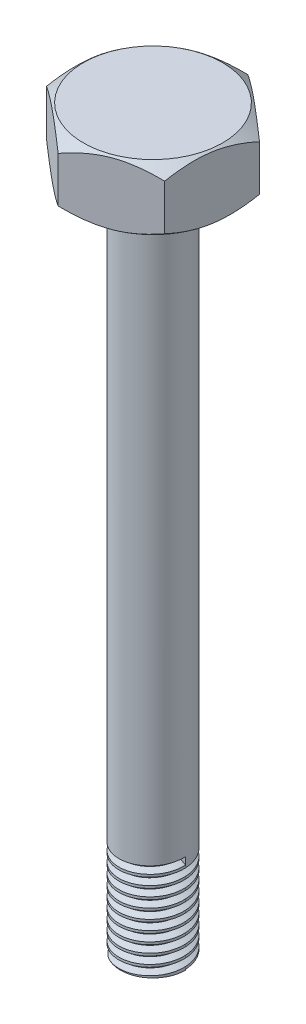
SolidWorks part; units mm, degrees
ref_plane "Front Plane" through (0, 0, 0) normal (0, 0, 1) x (1, 0, 0)
ref_plane "Top Plane" through (0, 0, 0) normal (0, 1, 0) x (1, 0, 0)
ref_plane "Right Plane" through (0, 0, 0) normal (1, 0, 0) x (0, 0, -1)
sketch "Sketch1" plane through (0, 0, 0) normal (0, 1, 0) x (1, 0, 0)
  circle A0 centre (0, 0) radius 5
  dimension "D1" = 10
extrude "Boss-Extrude1" add sketch "Sketch1" along normal blind 103
thread "Thread1" pitch 1.5 start angle 0, offset 1, length 15, pitch 1.5, diameter 10
ref_plane "Plane1" through (5, -1, 0) normal (0, 0, 1) x (1, 0, 0)
sketch "Thread Profile1" plane through (5, -1, 0) normal (0, 0, 1) x (1, 0, 0)
  line L0 (0, 0) -> (0, 1.5) construction
  line L1 (0, 1.125) -> (-0.8119, 0.6563)
  line L2 (-0.8119, 0.6563) -> (-0.8119, 0.4688)
  line L3 (-0.8119, 0.4688) -> (0, 0)
  line L4 (-0.8119, 0.5625) -> (0, 0.5625) construction
  line L11 (0, 1.125) -> (0, 0)
  point P6 (0, 0)
  dimension "Pitch" = 1.5
  dimension "Profile_Angle" = 60
  dimension "Profile_Land" = 0.1875
  dimension "Profile_Height" = 0.8119
sketch "Sketch4" plane through (0, 103, 0) normal (0, 1, 0) x (1, 0, 0)
  line L1 (11.8807, 4.4924) -> (2.0498, 12.5352)
  line L2 (2.0498, 12.5352) -> (-9.8309, 8.0428)
  line L3 (-9.8309, 8.0428) -> (-11.8807, -4.4924)
  line L4 (-11.8807, -4.4924) -> (-2.0498, -12.5352)
  line L5 (-2.0498, -12.5352) -> (9.8309, -8.0428)
  line L6 (9.8309, -8.0428) -> (11.8807, 4.4924)
  circle A0 centre (0, 0) radius 11 construction
  dimension "D1" = 22
extrude "Boss-Extrude2" add sketch "Sketch4" along normal blind 10
ref_plane "Plane2" through (0, 0, 0) normal (-0.9869, 0, -0.1614) x (-0.1614, 0, 0.9869)
sketch "Sketch5" plane through (0, 0, 0) normal (-0.9869, 0, -0.1614) x (-0.1614, 0, 0.9869)
  line L0 (0, 103) -> (0, 113) construction
  line L1 (-6.3509, 103) -> (6.3509, 103) construction
  line L2 (-6.3509, 113) -> (6.3509, 113) construction
  line L3 (-12.7017, 113) -> (-12.7017, 111.5)
  line L4 (-12.7017, 113) -> (-12.7017, 103) construction
  line L5 (-12.7017, 111.5) -> (-10.7017, 113)
  line L6 (-12.7017, 113) -> (-6.3509, 113) construction
  line L7 (-10.7017, 113) -> (-12.7017, 113)
  line L8 (-12.7017, 103) -> (-12.7017, 104.5)
  line L9 (-12.7017, 104.5) -> (-10.7017, 103)
  line L10 (-12.7017, 103) -> (-6.3509, 103) construction
  line L11 (-10.7017, 103) -> (-12.7017, 103)
  dimension "D1" = 2
  dimension "D2" = 1.5
  dimension "D3" = 1.5
  dimension "D4" = 2
revolve "Cut-Revolve1" cut sketch "Sketch5" angle 360 about L0
